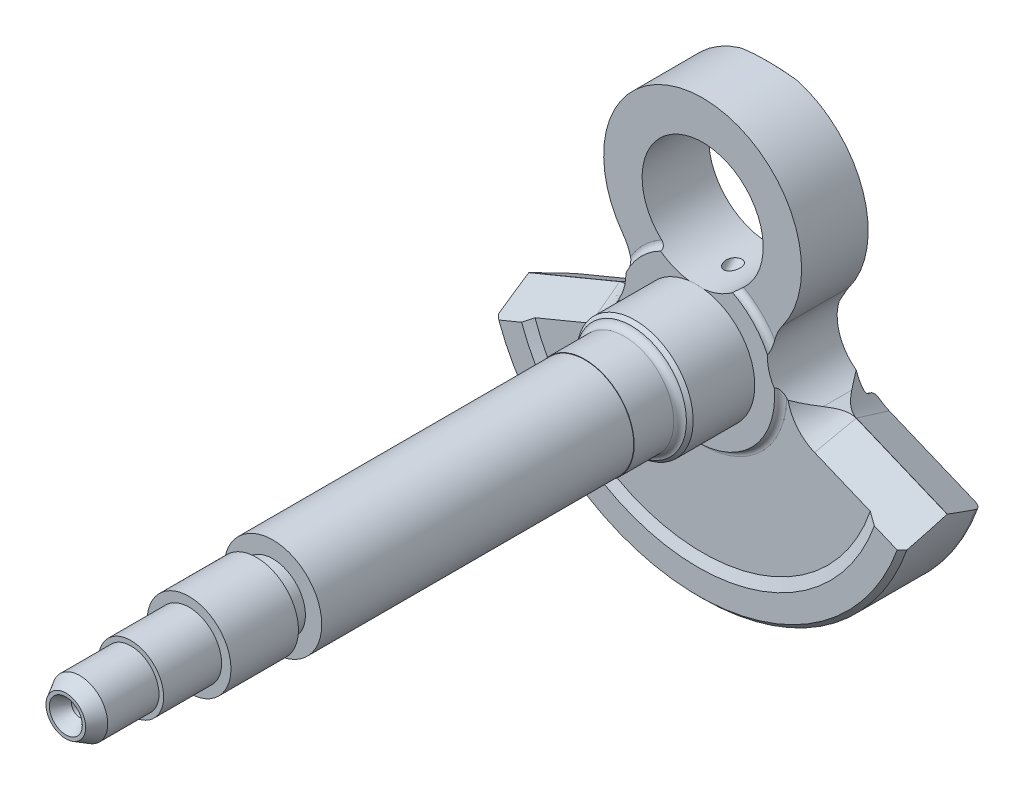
SolidWorks part; units mm, degrees
other "詳細ｱｲﾃﾑ1"
other "詳細ｱｲﾃﾑ2"
ref_plane "正面" through (0, 0, 0) normal (0, 0, 1) x (1, 0, 0)
ref_plane "平面" through (0, 0, 0) normal (0, 1, 0) x (1, 0, 0)
ref_plane "右側面" through (0, 0, 0) normal (1, 0, 0) x (0, 0, -1)
sketch "ｽｹｯﾁ1" plane through (0, 0, 0) normal (0, 0, 1) x (1, 0, 0)
  circle A0 centre (0, 0) radius 46.55
  dimension "D1" = 93.1
extrude "ﾎﾞｽ - 押し出し1" add sketch "ｽｹｯﾁ1" along normal blind 17.2
sketch "ｽｹｯﾁ2" plane through (0, 0, 17.2) normal (0, 0, 1) x (1, 0, 0)
  circle A0 centre (0, 0) radius 38.05
  dimension "D1" = 76.1
extrude "ｶｯﾄ - 押し出し1" cut sketch "ｽｹｯﾁ2" against normal blind 1
sketch "ｽｹｯﾁ3" plane through (0, 0, 0) normal (1, 0, 0) x (0, 0, -1)
  line L0 (-17.2, -38.05) -> (-17.2, -40.25)
  line L1 (-17.2, -40.25) -> (-16.2, -38.05)
  line L2 (-16.2, -38.05) -> (-17.2, -38.05)
  line L3 (-17.2, -46.55) -> (0, -46.55) construction
  line L4 (-17.2, 46.55) -> (-17.2, -46.55) construction
  line L9 (-16.2, 38.05) -> (-16.2, -38.05) construction
  line L11 (-17.2, 0) -> (0, 0) construction
  dimension "D1" = 6.3
  dimension "D2" = 38.05
revolve "ｶｯﾄ - 回転3" cut sketch "ｽｹｯﾁ3" angle 360 about axis through (0, 0, 17.2) along (0, 0, -1)
sketch "ｽｹｯﾁ4" plane through (0, 0, 16.2) normal (0, 0, 1) x (1, 0, 0)
  circle A0 centre (0, 0) radius 16.75
  dimension "D1" = 33.5
extrude "ﾎﾞｽ - 押し出し2" add sketch "ｽｹｯﾁ4" along normal blind 1.3
fillet "ﾌｨﾚｯﾄ1" radius 1.3 1 edges at (16.75, 0, 16.2)
sketch "ｽｹｯﾁ5" plane through (0, 0, 17.5) normal (0, 0, 1) x (1, 0, 0)
  circle A0 centre (0, 0) radius 12.5
  dimension "D1" = 25
extrude "ﾎﾞｽ - 押し出し3" add sketch "ｽｹｯﾁ5" along normal blind 14
sketch "ｽｹｯﾁ6" plane through (0, 0, 31.5) normal (0, 0, 1) x (1, 0, 0)
  circle A0 centre (0, 0) radius 10.6
  dimension "D1" = 21.2
extrude "ﾎﾞｽ - 押し出し4" add sketch "ｽｹｯﾁ6" along normal blind 10
sketch "ｽｹｯﾁ7" plane through (0, 0, 41.5) normal (0, 0, 1) x (1, 0, 0)
  circle A0 centre (0, 0) radius 10.5
  dimension "D1" = 21
extrude "ﾎﾞｽ - 押し出し5" add sketch "ｽｹｯﾁ7" along normal blind 67
fillet "ﾌｨﾚｯﾄ2" radius 1.5 1 edges at (10.6, 0, 31.5)
chamfer "面取り1" distance 0.8 angle 45 1 edges at (12.5, 0, 31.5)
chamfer "面取り3" distance 1 angle 45 1 edges at (46.55, 0, 17.2)
sketch "ｽｹｯﾁ11" plane through (0, 0, 0) normal (0, 0, -1) x (-1, 0, 0)
  line L0 (0, 0) -> (0, 25.3) construction
  circle A0 centre (0, 25.3) radius 13
  dimension "D1" = 26
  dimension "D2" = 25.3
extrude "ｶｯﾄ - 押し出し3" cut sketch "ｽｹｯﾁ11" against normal up to surface (17.5 mm away)
sketch "ｽｹｯﾁ12" plane through (0, 0, 0) normal (0, 0, -1) x (-1, 0, 0)
  line L0 (-29.8233, 3.2511) -> (-49.7055, 5.4186)
  line L1 (0, 25.3) -> (-5.3323, -23.6143) construction
  line L2 (-46.2758, 5.0447) -> (-48.8174, -18.2693) construction
  line L3 (0, 0) -> (16.2586, 4.3161) construction
  line L4 (16.2586, 4.3161) -> (25.3966, 6.742) construction
  line L5 (24.372, -2.6569) -> (49.7055, -5.4186)
  line L6 (46.2758, -5.0447) -> (45.7826, -9.5691) construction
  line L7 (0, 0) -> (-20.1425, 8.8477) construction
  line L8 (-20.1425, 8.8477) -> (-28.7987, 12.65) construction
  arc A0 (-20.1425, 16.4523) -> (17.763, 12.3201) centre (0, 25.3) cw
  arc A1 (-29.8233, 3.2511) -> (-20.1425, 16.4523) centre (-28.7987, 12.65) ccw
  circle A2 centre (0, 0) radius 46.55 construction
  arc A3 (24.372, -2.6569) -> (17.763, 12.3201) centre (25.3966, 6.742) cw
  arc A5 (-49.7055, 5.4186) -> (49.7055, -5.4186) centre (0, 0) cw
  dimension "D1" = 22
  dimension "D2" = 30
  dimension "D5" = 50
  dimension "D3" = 22
  dimension "D6" = 22.0336
extrude "ｶｯﾄ - 押し出し4" cut sketch "ｽｹｯﾁ12" against normal blind 9.6
sketch "ｽｹｯﾁ13" plane through (0, 0, 0) normal (0, 0, -1) x (-1, 0, 0)
  line L1 (17.763, 12.3201) -> (24.372, -2.6569)
  line L2 (-20.1425, 16.4523) -> (-29.8233, 3.2511)
  line L3 (0, 0) -> (25.5952, 0) construction
  line L4 (24.372, -2.6569) -> (46.2758, -5.0447) construction
  line L5 (-28.7987, 12.65) -> (25.3966, 6.742) construction
  arc A0 (-20.1425, 16.4523) -> (-4.6463, 3.7962) centre (0, 25.3) ccw
  arc A4 (-4.6463, 3.7962) -> (4.6463, 3.7962) centre (0, 0) cw
  arc A5 (4.6463, 3.7962) -> (17.763, 12.3201) centre (0, 25.3) ccw
  arc A6 (24.372, -2.6569) -> (-29.8233, 3.2511) centre (0, 25.3) cw
  arc A7 (17.763, 12.3201) -> (7.6988, 45.9089) centre (0, 25.3) ccw construction
  arc A8 (-29.8233, 3.2511) -> (-20.1425, 16.4523) centre (-28.7987, 12.65) ccw construction
  arc A9 (17.763, 12.3201) -> (24.372, -2.6569) centre (25.3966, 6.742) ccw construction
  dimension "D1" = 6
extrude "ｶｯﾄ - 押し出し5" cut sketch "ｽｹｯﾁ13" against normal blind 2.5
hole_wizard "Ø4.0 (4) 直径の穴1" positions "ｽｹｯﾁ15" profile "ｽｹｯﾁ14" hole size "Ø4.0" standard "Jis"
sketch "ｽｹｯﾁ15" plane through (0, 0, 2.5) normal (0, 0, -1) x (-1, 0, 0)
  point P0 (0, 0)
sketch "ｽｹｯﾁ14" plane through (0, 0, 2.5) normal (1, 0, 0) x (0, 1, 0)
  line L0 (0, 0) -> (0, 7.9017)
  line L1 (0, 7.9017) -> (2, 6.7)
  line L2 (2, 6.7) -> (2, 0)
  line L5 (2, 0) -> (0, 0)
  line L10 (0, 7.9017) -> (-2, 6.7) construction
  line L11 (0, -6.35) -> (0, 107.95) construction
  dimension "穴の直径" = 4
  dimension "穴の深さ" = 6.7
  dimension "ﾄﾞﾘﾙ角度" = 118
sketch "ｽｹｯﾁ16" plane through (0, 0, 0) normal (0, 1, 0) x (1, 0, 0)
  line L0 (0, -2.5) -> (-3.5, -2.5)
  line L2 (-3.5, -2.5) -> (0, -8.5622)
  line L3 (0, -9.6) -> (0, 0) construction
  line L4 (0, -16.2) -> (0, 0) construction
  line L5 (0, -8.5622) -> (0, -2.5)
  line L7 (2, -2.5) -> (-2, -2.5) construction
  dimension "D1" = 3.5
  dimension "D2" = 30
revolve "ｶｯﾄ - 回転4" cut sketch "ｽｹｯﾁ16" angle 360 about L5
sketch "ｽｹｯﾁ17" plane through (0, 0, 0) normal (0, 0, -1) x (-1, 0, 0)
  circle A0 centre (0, 25.3) radius 22
  arc A1 (4.6463, 3.7962) -> (17.763, 12.3201) centre (0, 25.3) ccw construction
extrude "ｶｯﾄ - 押し出し6" cut sketch "ｽｹｯﾁ17" against normal offset from surface (1.9 mm away) 15.3
fillet "ﾌｨﾚｯﾄ5" radius 5 2 edges at (-4.6463, 3.7962, 2.2) (4.6463, 3.7962, 2.2)
fillet "ﾌｨﾚｯﾄ6" radius 2 2 edges at (29.8233, 3.2511, 1.25) (-24.372, -2.6569, 1.25)
fillet "ﾌｨﾚｯﾄ7" radius 2 2 edges at (-46.2758, -5.0447, 4.8) (46.2758, 5.0447, 4.8)
fillet "ﾌｨﾚｯﾄ8" radius 1 4 edges at (-24.8006, -2.7036, 2.5) (30.2519, 3.2979, 2.5) (-16.7468, 2.925, 2.5) (21.1745, 7.0589, 2.5)
fillet "ﾌｨﾚｯﾄ9" radius 1 7 edges at (4.0194, -11.5704, 2.5)
fillet "ﾌｨﾚｯﾄ10" radius 1.5 8 edges at (-24.435, -2.8237, 0) (4.0194, -11.5704, 0) (29.9208, 3.1018, 0) (37.4617, 4.0838, 0) (45.747, 4.3655, 0) (5.0447, -46.2758, 0) (-45.6131, -5.594, 0) (-34.7361, -3.7867, 0)
fillet "ﾌｨﾚｯﾄ11" radius 1 8 edges at (20.2659, 33.8611, 9.6) (21.1745, 7.0589, 9.6) (37.0331, 4.0371, 9.6) (-21.0743, 31.6145, 9.6) (-16.7468, 2.925, 9.6) (-34.3075, -3.74, 9.6) (45.747, 4.3655, 9.6) (-45.6131, -5.594, 9.6)
chamfer "面取り4" distance 0.5 angle 45 6 edges at (21.9998, 25.2158, 1.9) (5.3069, 4.357, 1.9) (0, 6, 1.9) (-5.3069, 4.357, 1.9) (0, 46.55, 1.9) (-21.9998, 25.2158, 1.9)
sketch "ｽｹｯﾁ18" plane through (0, 0, 108.5) normal (0, 0, 1) x (1, 0, 0)
  circle A0 centre (0, 0) radius 7
  dimension "D1" = 14
extrude "ﾎﾞｽ - 押し出し7" add sketch "ｽｹｯﾁ18" along normal blind 3.5
sketch "ｽｹｯﾁ19" plane through (0, 0, 112) normal (0, 0, 1) x (1, 0, 0)
  circle A0 centre (0, 0) radius 9
  dimension "D1" = 18
extrude "ﾎﾞｽ - 押し出し8" add sketch "ｽｹｯﾁ19" along normal blind 14.5
sketch "ｽｹｯﾁ20" plane through (0, 0, 126.5) normal (0, 0, 1) x (1, 0, 0)
  circle A0 centre (0, 0) radius 7
  dimension "D1" = 14
extrude "ﾎﾞｽ - 押し出し11" add sketch "ｽｹｯﾁ20" along normal blind 12.45
sketch "ｽｹｯﾁ21" plane through (0, 0, 138.95) normal (0, 0, 1) x (1, 0, 0)
  circle A0 centre (0, 0) radius 6
  dimension "D1" = 12
extrude "ﾎﾞｽ - 押し出し12" add sketch "ｽｹｯﾁ21" along normal blind 14
chamfer "面取り5" distance 3 angle 30 1 edges at (6, 0, 152.95)
hole_wizard "Ø3.6 (3.6) 直径の穴1" positions "ｽｹｯﾁ23" profile "ｽｹｯﾁ22" hole size "Ø3.6" standard "Jis"
sketch "ｽｹｯﾁ23" plane through (0, 0, 152.95) normal (0, 0, 1) x (1, 0, 0)
  point P0 (0, 0)
sketch "ｽｹｯﾁ22" plane through (0, 0, 152.95) normal (1, 0, 0) x (0, -1, 0)
  line L0 (0, 0) -> (0, 140.3815)
  line L1 (0, 140.3815) -> (1.8, 139.3)
  line L2 (1.8, 139.3) -> (1.8, 0)
  line L5 (1.8, 0) -> (0, 0)
  line L10 (0, 140.3815) -> (-1.8, 139.3) construction
  line L11 (0, -6.35) -> (0, 107.95) construction
  dimension "穴の直径" = 3.6
  dimension "穴の深さ" = 139.3
  dimension "ﾄﾞﾘﾙ角度" = 118
chamfer "面取り6" distance 3 angle 30 1 edges at (1.8, 0, 152.95)
sketch "ｽｹｯﾁ24" plane through (0, 0, 0) normal (1, 0, 0) x (0, 0, -1)
  line L0 (-7.7716, 14.5981) -> (-20.0209, 0)
  line L1 (-20.0209, 0) -> (-18.8719, -0.9642)
  line L2 (-18.8719, -0.9642) -> (-6.6226, 13.634)
  line L3 (-6.6226, 13.634) -> (-7.7716, 14.5981)
  line L8 (-13.65, 0) -> (-149.95, 0) construction
  line L9 (-6.6226, 13.634) -> (12.6938, 36.6543) construction
  line L10 (-9.7, 12.3) -> (-9.7, 15.0111) construction
  line L11 (-17.5, 12.3) -> (-1.9, 12.3) construction
  line L12 (-30.735, 0) -> (-17.5, 0) construction
  dimension "D1" = 50
  dimension "D2" = 1.5
  dimension "D3" = 3
revolve "ｶｯﾄ - 回転5" cut sketch "ｽｹｯﾁ24" angle 360 about L0
sketch "ｽｹｯﾁ25" plane through (0, 0, 1.9) normal (0, 0, -1) x (-1, 0, 0)
  line L0 (21.3587, -2.4388) -> (48.1347, -13.5298)
  line L1 (-21.3587, -2.4388) -> (-48.1347, -13.5298)
  line L4 (0, 0) -> (0, -35.3307) construction
  arc A0 (17.1262, 12.72) -> (-17.1262, 12.72) centre (0, 25.3) ccw
  arc A2 (7.6988, 45.9089) -> (-7.6988, 45.9089) centre (0, 0) ccw construction
  arc A3 (-21.3587, -2.4388) -> (-17.1262, 12.72) centre (-25.1856, 6.8) ccw
  arc A4 (17.1262, 12.72) -> (21.3587, -2.4388) centre (25.1856, 6.8) ccw
  arc A5 (48.1347, -13.5298) -> (-48.1347, -13.5298) centre (0, 0) ccw
  dimension "D1" = 10
  dimension "D2" = 10
  dimension "D3" = 50
  dimension "D4" = 135
  dimension "D5" = 6.8
extrude "ｶｯﾄ - 押し出し7" cut sketch "ｽｹｯﾁ25" against normal through all and the other way through all
sketch "ｽｹｯﾁ26" plane through (0, 0, 16.2) normal (0, 0, 1) x (1, 0, 0)
  line L1 (-23, 47.3) -> (23, 47.3)
  line L2 (-23, 47.3) -> (-23, 29.3)
  line L3 (-23, 29.3) -> (23, 29.3)
  line L4 (23, 47.3) -> (23, 29.3)
  dimension "D1" = 23
  dimension "D2" = 23
  dimension "D3" = 4
  dimension "D4" = 18
extrude "ｶｯﾄ - 押し出し8" cut sketch "ｽｹｯﾁ26" along normal through all
sketch "ｽｹｯﾁ29" plane through (0, 0, 0) normal (0, 0, -1) x (-1, 0, 0)
  line L0 (23.8587, -7.8039) -> (55.2706, -20.8151)
  line L1 (55.2706, -20.8151) -> (62.9243, -2.3375)
  line L2 (62.9243, -2.3375) -> (31.5124, 10.6737)
  line L3 (31.5124, 10.6737) -> (23.8587, -7.8039) construction
  line L5 (25.9409, -4.3368) -> (43.5255, -11.6206) construction
  arc A0 (31.5124, 10.6737) -> (23.8587, -7.8039) centre (27.6856, 1.4349) ccw
  dimension "D2" = 10
  dimension "D1" = 4
  dimension "D3" = 2.5
  dimension "D4" = 34
extrude "ｶｯﾄ - 押し出し10" cut sketch "ｽｹｯﾁ29" against normal through all draft 25
sketch "ｽｹｯﾁ30" plane through (0, 0, 0) normal (0, 0, -1) x (-1, 0, 0)
  line L0 (-52.499, -19.6671) -> (-23.8587, -7.8039)
  line L1 (-52.499, -19.6671) -> (-60.1527, -1.1895)
  line L2 (-60.1527, -1.1895) -> (-31.5124, 10.6737)
  line L3 (-23.8587, -7.8039) -> (-31.5124, 10.6737) construction
  line L7 (-21.3587, -2.4388) -> (-36.9911, -8.914) construction
  arc A0 (-31.5124, 10.6737) -> (-23.8587, -7.8039) centre (-27.6856, 1.4349) cw
  arc A2 (-21.3587, -2.4388) -> (-15.6621, 9.8501) centre (-25.1856, 6.8) ccw construction
  dimension "D2" = 10
  dimension "D1" = 4
  dimension "D3" = 2.5
  dimension "D4" = 31
extrude "ｶｯﾄ - 押し出し11" cut sketch "ｽｹｯﾁ30" against normal through all draft 25
sketch "ｽｹｯﾁ31" plane through (0, 0, 17.2) normal (0, 0, 1) x (1, 0, 0)
  line L0 (60.2847, -1.2442) -> (52.6311, -19.7218)
  line L1 (52.6311, -19.7218) -> (23.8587, -7.8039)
  line L2 (60.2847, -1.2442) -> (31.5124, 10.6737)
  line L3 (23.8587, -7.8039) -> (31.5124, 10.6737) construction
  line L6 (21.3587, -2.4388) -> (36.9911, -8.914) construction
  arc A0 (31.5124, 10.6737) -> (23.8587, -7.8039) centre (27.6856, 1.4349) ccw
  arc A1 (18.0488, -0.2048) -> (21.3587, -2.4388) centre (25.1856, 6.8) ccw construction
  dimension "D1" = 10
  dimension "D2" = 4
  dimension "D3" = 2.5
  dimension "D4" = 10
extrude "ｶｯﾄ - 押し出し12" cut sketch "ｽｹｯﾁ31" against normal through all draft 25
sketch "ｽｹｯﾁ32" plane through (0, 0, 17.2) normal (0, 0, 1) x (1, 0, 0)
  line L0 (-58.0423, -21.9632) -> (-23.8587, -7.8039)
  line L1 (-23.8587, -7.8039) -> (-31.5124, 10.6737) construction
  line L2 (-31.5124, 10.6737) -> (-65.6959, -3.4856)
  line L3 (-65.6959, -3.4856) -> (-58.0423, -21.9632)
  line L4 (-25.3895, -4.1084) -> (-44.923, -12.1994) construction
  arc A0 (-23.8587, -7.8039) -> (-31.5124, 10.6737) centre (-27.6856, 1.4349) ccw
  dimension "D3" = 10
  dimension "D4" = 37
  dimension "D1" = 4
  dimension "D2" = 2.5
extrude "ｶｯﾄ - 押し出し13" cut sketch "ｽｹｯﾁ32" against normal through all draft 25
